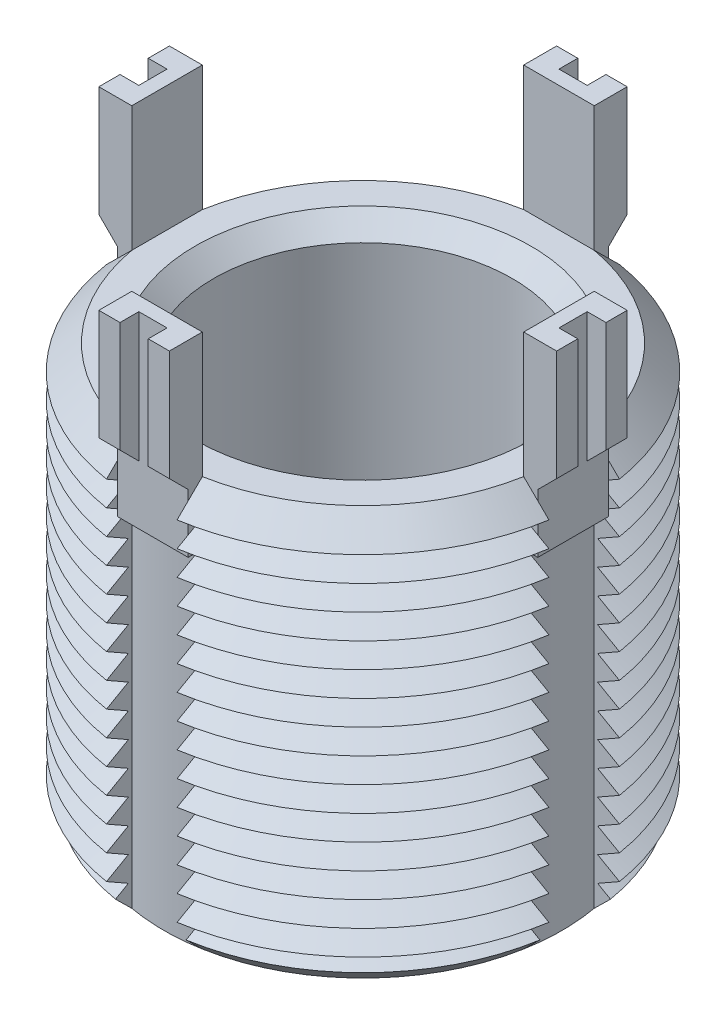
SolidWorks part; units mm, degrees
ref_plane "Front Plane" through (0, 0, 0) normal (0, 0, 1) x (1, 0, 0)
ref_plane "Top Plane" through (0, 0, 0) normal (0, 1, 0) x (1, 0, 0)
ref_plane "Right Plane" through (0, 0, 0) normal (1, 0, 0) x (0, 0, -1)
sketch "Sketch1" plane through (0, 0, 0) normal (0, 1, 0) x (1, 0, 0)
  circle A0 centre (0, 0) radius 19.05
  dimension "D1" = 38.1
extrude "Boss-Extrude1" add sketch "Sketch1" against normal blind 34.798
chamfer "Chamfer1" distance 2.117 angle 45 2 edges at (0, -34.798, 19.05) (0, 0, 19.05)
sketch "Sketch2" plane through (0, 0, 0) normal (1, 0, 0) x (0, 0, -1)
  line L0 (0, 0.8859) -> (0, -9.2617) construction
sketch "Sketch3" plane through (0, 0, 0) normal (1, 0, 0) x (0, 0, -1)
  line L0 (-19.05, -2.117) -> (-17.2166, -3.1755)
  line L1 (-17.2166, -3.1755) -> (-19.05, -4.234)
  line L2 (-19.05, -2.117) -> (-19.05, -32.681) construction
  line L3 (-19.05, -4.234) -> (-19.05, -2.117)
  dimension "D1" = 2.117
revolve "Cut-Revolve1" cut sketch "Sketch3" angle 360 about L0
pattern_linear "LPattern1" count 15 spacing 2.117 along (0, -1, 0) of "Cut-Revolve1"
sketch "Sketch4" plane through (0, 0, 0) normal (0, 1, 0) x (1, 0, 0)
  line L0 (-16.6651, 3) -> (-18.8123, 3)
  line L2 (-18.8123, -3) -> (-16.6651, -3)
  arc A0 (-16.6651, 3) -> (-16.6651, -3) centre (0, 0) ccw
  arc A1 (-18.8123, 3) -> (-18.8123, -3) centre (0, 0) ccw
  circle A2 centre (0, 0) radius 19.05 construction
  circle A3 centre (0, 0) radius 16.933 construction
  point P1 (-16.933, 0)
  point P3 (-19.05, 0)
  point P13 (0, 0)
  dimension "D1" = 6
extrude "Cut-Extrude1" cut sketch "Sketch4" against normal up to surface (34.798 mm away)
pattern_circular "CirPattern1" count 4 over 360 about axis through (0, 0, 0) along (0, 1, 0) of "Cut-Extrude1"
sketch "Sketch5" plane through (0, 0, 0) normal (1, 0, 0) x (0, 0, -1)
  line L0 (-16.6651, 10.649) -> (-16.6651, -5.351)
  line L1 (-16.6651, -5.351) -> (-17.8651, -5.351)
  line L2 (-17.8651, -5.351) -> (-17.8651, -0.351)
  line L3 (-17.8651, -0.351) -> (-19.4651, 1.249)
  line L4 (-19.4651, 1.249) -> (-19.4651, 10.649)
  line L5 (-19.4651, 10.649) -> (-16.6651, 10.649)
  line L6 (-18.8123, -6.351) -> (-3, -6.351) construction
  point P9 (-3, 0)
  point P10 (-17.8651, -0.351)
  dimension "D1" = 1
  dimension "D2" = 16
  dimension "D3" = 11
  dimension "D4" = 2.8
  dimension "D5" = 1.2
  dimension "D6" = 45
extrude "Boss-Extrude3" add sketch "Sketch5" along normal mid plane 6
pattern_circular "CirPattern2" count 4 over 360 about axis through (0, 0, 0) along (0, 1, 0) of "Boss-Extrude3"
sketch "Sketch6" plane through (0, 10.649, 0) normal (0, 1, 0) x (1, 0, 0)
  line L0 (-19.4651, -3) -> (-19.4651, 3) construction
  line L1 (-19.4651, -1.2) -> (-17.8651, -1.2)
  line L2 (-19.4651, -1.2) -> (-19.4651, 1.2)
  line L3 (-19.4651, 1.2) -> (-17.8651, 1.2)
  line L4 (-17.8651, -1.2) -> (-17.8651, 1.2)
  line L5 (-19.4651, -1.2) -> (-17.8651, 1.2) construction
  line L6 (-19.4651, 1.2) -> (-17.8651, -1.2) construction
  line L7 (19.4651, 3) -> (19.4651, -3) construction
  line L8 (-1.2, 17.8651) -> (1.2, 17.8651)
  line L9 (-1.2, 17.8651) -> (-1.2, 19.4651)
  line L10 (-1.2, 19.4651) -> (1.2, 19.4651)
  line L11 (1.2, 17.8651) -> (1.2, 19.4651)
  line L12 (-1.2, 17.8651) -> (1.2, 19.4651) construction
  line L13 (-1.2, 19.4651) -> (1.2, 17.8651) construction
  line L14 (17.8651, -1.2) -> (19.4651, -1.2)
  line L15 (17.8651, -1.2) -> (17.8651, 1.2)
  line L16 (17.8651, 1.2) -> (19.4651, 1.2)
  line L17 (19.4651, -1.2) -> (19.4651, 1.2)
  line L18 (17.8651, -1.2) -> (19.4651, 1.2) construction
  line L19 (17.8651, 1.2) -> (19.4651, -1.2) construction
  line L20 (-1.2, -19.4651) -> (1.2, -19.4651)
  line L21 (-1.2, -19.4651) -> (-1.2, -17.8651)
  line L22 (-1.2, -17.8651) -> (1.2, -17.8651)
  line L23 (1.2, -19.4651) -> (1.2, -17.8651)
  line L24 (-1.2, -19.4651) -> (1.2, -17.8651) construction
  line L25 (-1.2, -17.8651) -> (1.2, -19.4651) construction
  line L26 (-3, 19.4651) -> (3, 19.4651) construction
  line L27 (3, -19.4651) -> (-3, -19.4651) construction
  point P0 (-18.6651, 0)
  point P7 (-19.4651, 0)
  point P8 (-19.4651, 0)
  point P9 (0, 18.6651)
  point P14 (18.6651, 0)
  point P19 (0, -18.6651)
  point P24 (0, 19.4651)
  point P25 (19.4651, 0)
  point P26 (19.4651, 0)
  point P27 (0, 19.4651)
  point P30 (0, -19.4651)
  point P33 (0, -19.4651)
  dimension "D1" = 2.4
  dimension "D2" = 1.6
extrude "Cut-Extrude3" cut sketch "Sketch6" against normal through all both and the other way through all
sketch "Sketch7" plane through (0, 0, 0) normal (0, 1, 0) x (1, 0, 0)
  circle A0 centre (0, 0) radius 12.7
  dimension "D1" = 25.4
extrude "Cut-Extrude4" cut sketch "Sketch7" against normal up to surface (34.798 mm away)
chamfer "Chamfer2" distance 1.5875 angle 45 2 edges at (0, 0, 12.7) (0, -34.798, 12.7)
